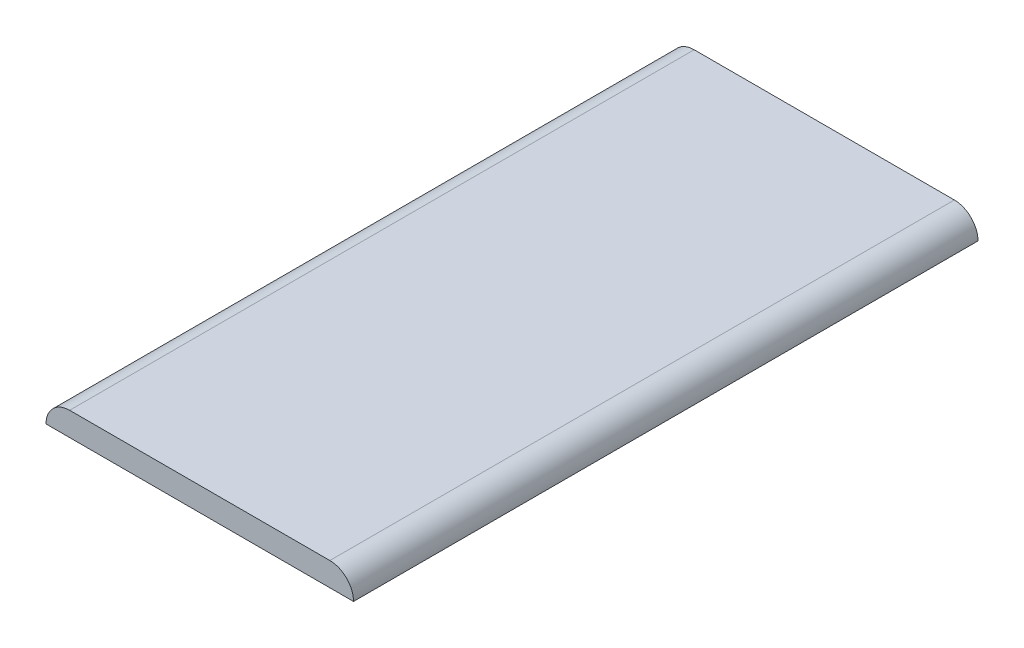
SolidWorks part; units mm, degrees
ref_plane "Front Plane" through (0, 0, 0) normal (0, 0, 1) x (1, 0, 0)
ref_plane "Top Plane" through (0, 0, 0) normal (0, 1, 0) x (1, 0, 0)
ref_plane "Right Plane" through (0, 0, 0) normal (1, 0, 0) x (0, 0, -1)
sketch "Sketch2" plane through (0, 0, 0) normal (0, 0, 1) x (1, 0, 0)
  line L1 (0, 0) -> (65, 0)
  line L2 (0, 0) -> (0, 30)
  line L3 (0, 30) -> (65, 30)
  line L4 (65, 0) -> (65, 30)
  dimension "D1" = 65
  dimension "D2" = 30
extrude "Boss-Extrude1" add sketch "Sketch2" along normal blind 132
chamfer "Chamfer1" distance 12 angle 55 1 edges at (65, 0, 66)
fillet "Fillet1" radius 10 1 edges at (65, 17.1378, 66)
chamfer "Chamfer3" distance 12 angle 55 1 edges at (0, 0, 66)
fillet "Fillet2" radius 10 1 edges at (0, 17.1378, 66)
fillet "Fillet3" radius 5 1 edges at (65, 30, 66)
fillet "Fillet4" radius 5 1 edges at (0, 30, 66)
fillet "Fillet6" radius 5 2 edges at (12, 0, 66) (53, 0, 66)
sketch "Sketch4" plane through (0, 0, 0) normal (0, -1, 0) x (1, 0, 0)
  line L1 (0, 132) -> (65, 132)
  line L2 (0, 132) -> (0, 0)
  line L3 (0, 0) -> (65, 0)
  line L4 (65, 132) -> (65, 0)
extrude "Cut-Extrude2" cut sketch "Sketch4" against normal blind 25
